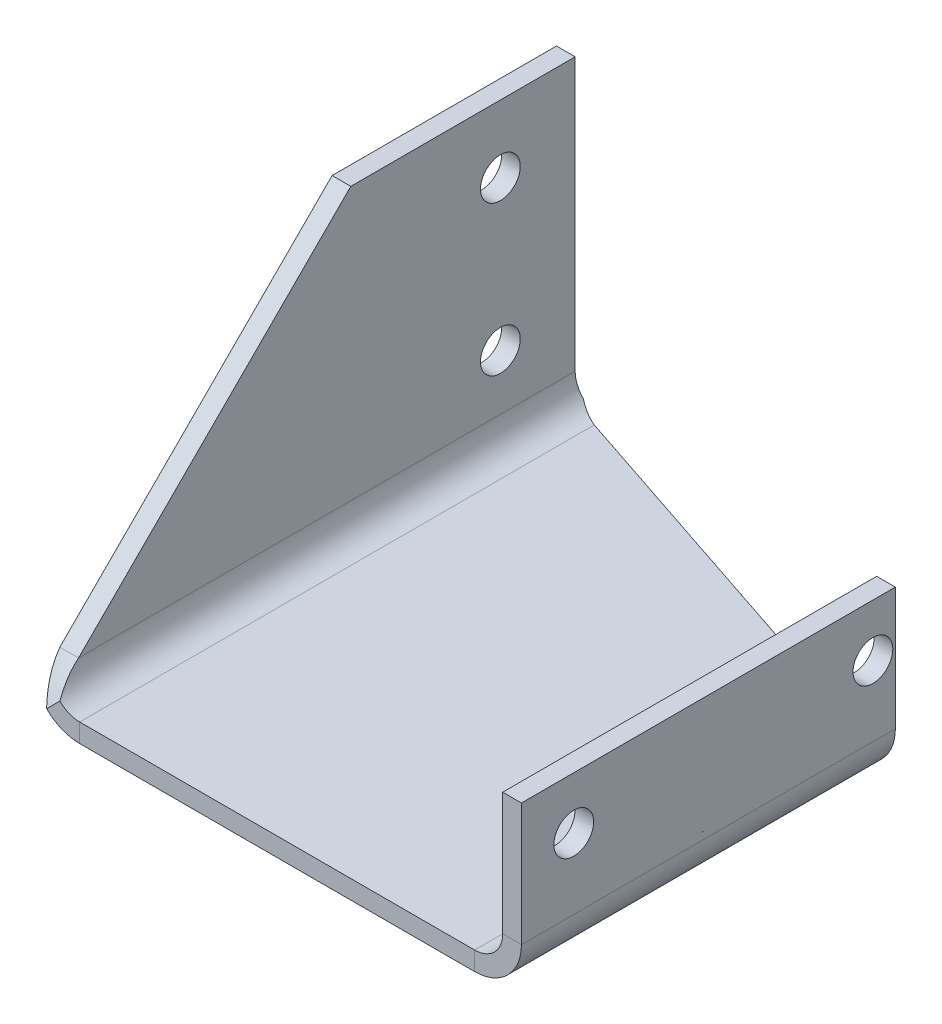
SolidWorks part; units mm, degrees
ref_plane "Front" through (0, 0, 0) normal (0, 0, 1) x (1, 0, 0)
ref_plane "Top" through (0, 0, 0) normal (0, 1, 0) x (1, 0, 0)
ref_plane "Right" through (0, 0, 0) normal (1, 0, 0) x (0, 0, -1)
sketch "Sketch3" plane through (0, 0, 0) normal (0, 1, 0) x (1, 0, 0)
  line L0 (0, 0) -> (0, -38.1)
  line L1 (0, -38.1) -> (50.8, -88.9)
  line L2 (50.8, -88.9) -> (127, -88.9)
  line L4 (50.8, 0) -> (0, 0)
  line L5 (50.8, 0) -> (50.8, -88.9) construction
  line L6 (50.8, 0) -> (127, -25.4)
  line L7 (127, -25.4) -> (127, -88.9) construction
  line L9 (127, -25.4) -> (152.4, -25.4)
  line L10 (152.4, -25.4) -> (152.4, -88.9)
  line L11 (152.4, -88.9) -> (127, -88.9)
  dimension "D1" = 25.4
  dimension "D2" = 38.1
  dimension "D3" = 63.5
  dimension "D4" = 76.2
  dimension "D5" = 50.8
  dimension "D6" = 50.8
base flange "Base-Flange1" sketch "Sketch3" thickness 3.175 reverse thickness direction no parameters "D1"=4.7625
sketch "Sketch8" plane through (0, 0, 0) normal (0, 1, 0) x (1, 0, 0)
  line L0 (50.8, 0) -> (50.8, -88.9) construction
  line L1 (50.8, 0) -> (50.8, -88.9)
  line L2 (127, -25.4) -> (127, -88.9) construction
  line L3 (127, -25.4) -> (127, -88.9)
sketched bend "Sketched Bend2" thickness 3.175 parameters "D1"=0
bend "SketchBend3" bend radius 4.7625 bend angle 90 parameters "D5"=1
bend "SketchBend4" bend radius 0 bend angle 90 parameters "D5"=2
sketch "Sketch9" plane through (47.4259, 0, 0) normal (-1, 0, 0) x (0, 0, 1)
  line L0 (0, 4.7625) -> (0, 50.9991) construction
  line L1 (0, 50.9991) -> (38.1, 50.9991) construction
  point P0 (12.7, 39.5691)
  point P2 (12.7, 14.1691)
  dimension "D1" = 25.4
  dimension "D2" = 12.7
  dimension "D3" = 11.43
hole_wizard "1/4 Clearance Hole1" positions "Sketch9" profile "Sketch10" hole size "1/4" standard "ANSI Inch"
sketch "Sketch10" plane through (47.4259, 39.5691, 12.7) normal (0, 1, 0) x (0, 0, 1)
  line L0 (0, 0) -> (0, 3.175)
  line L1 (0, 3.175) -> (3.3782, 3.175)
  line L2 (3.3782, 3.175) -> (3.3782, 0)
  line L5 (3.3782, 0) -> (0, 0)
  line L11 (0, -6.35) -> (0, 107.95) construction
  dimension "Thru Hole Dia." = 6.7564
  dimension "Thru Hole Depth" = 3.175
sketch "Sketch11" plane through (130.3741, 0, 0) normal (1, 0, 0) x (0, 0, -1)
  line L0 (-88.9, 25.5991) -> (-25.4, 25.5991) construction
  line L1 (-88.9, 4.7625) -> (-88.9, 25.5991) construction
  point P0 (-80.01, 16.7091)
  point P2 (-29.21, 16.7091)
  point P7 (0, 0)
  dimension "D1" = 50.8
  dimension "D2" = 8.89
  dimension "D3" = 8.89
hole_wizard "1/4 Clearance Hole2" positions "Sketch11" profile "Sketch12" hole size "1/4" standard "ANSI Inch"
sketch "Sketch12" plane through (130.3741, 16.7091, 80.01) normal (0, 1, 0) x (0, 0, -1)
  line L0 (0, 0) -> (0, 3.175)
  line L1 (0, 3.175) -> (3.3782, 3.175)
  line L2 (3.3782, 3.175) -> (3.3782, 0)
  line L5 (3.3782, 0) -> (0, 0)
  line L11 (0, -6.35) -> (0, 107.95) construction
  dimension "Thru Hole Dia." = 6.7564
  dimension "Thru Hole Depth" = 3.175
sketch "Bend-Lines1" [suppressed] plane through (0, 0, 0) normal (0, 1, 0) x (1, 0, 0)
sketch "Bounding-Box1" [suppressed] plane through (0, 0, 0) normal (0, 1, 0) x (1, 0, 0)
sheet metal parameters "Sheet-Metal5" thickness 3.175 parameters "D1"=4.7625
flat pattern "Flat-Pattern5"
sketch "Bend-Lines2" plane through (0, 0, 0) normal (0, 1, 0) x (1, 0, 0)
  line L0 (127, -88.9) -> (127, -25.4) construction
  line L1 (50.8, 0) -> (50.8, -88.9) construction
  line L2 (127, -88.9) -> (127, -25.4) construction
  line L3 (50.8, 0) -> (50.8, -88.9) construction
sketch3d "Bounding-Box2" [suppressed]
  line L0 (152.4, -88.9, 0) -> (0, -88.9, 0) construction
  line L1 (152.4, 0, 0) -> (0, 0, 0) construction
  line L2 (152.4, -88.9, 0) -> (152.4, 0, 0) construction
  line L3 (0, -88.9, 0) -> (0, 0, 0) construction
bend of the flat pattern "Flatten-<SketchBend3>1"
bend of the flat pattern "Flatten-<SketchBend4>1"
sheet metal parameters "Sheet-Metal6" thickness 3.175 parameters "D1"=4.7625
flat pattern "Flat-Pattern5"
sketch "Bend-Lines2" plane through (0, 0, 0) normal (0, 1, 0) x (1, 0, 0)
  line L0 (127, -88.9) -> (127, -25.4) construction
  line L1 (50.8, 0) -> (50.8, -88.9) construction
  line L2 (127, -88.9) -> (127, -25.4) construction
  line L3 (50.8, 0) -> (50.8, -88.9) construction
sketch3d "Bounding-Box2" [suppressed]
  line L0 (152.4, -88.9, 0) -> (0, -88.9, 0) construction
  line L1 (152.4, 0, 0) -> (0, 0, 0) construction
  line L2 (152.4, -88.9, 0) -> (152.4, 0, 0) construction
  line L3 (0, -88.9, 0) -> (0, 0, 0) construction
bend of the flat pattern "Flatten-<SketchBend3>1"
bend of the flat pattern "Flatten-<SketchBend4>1"
sheet metal parameters "Sheet-Metal7" thickness 3.175 parameters "D1"=4.7625
flat pattern "Flat-Pattern5"
sketch "Bend-Lines2" plane through (0, 0, 0) normal (0, 1, 0) x (1, 0, 0)
  line L0 (127, -88.9) -> (127, -25.4) construction
  line L1 (50.8, 0) -> (50.8, -88.9) construction
  line L2 (127, -88.9) -> (127, -25.4) construction
  line L3 (50.8, 0) -> (50.8, -88.9) construction
sketch3d "Bounding-Box2" [suppressed]
  line L0 (152.4, -88.9, 0) -> (0, -88.9, 0) construction
  line L1 (152.4, 0, 0) -> (0, 0, 0) construction
  line L2 (152.4, -88.9, 0) -> (152.4, 0, 0) construction
  line L3 (0, -88.9, 0) -> (0, 0, 0) construction
bend of the flat pattern "Flatten-<SketchBend3>1"
bend of the flat pattern "Flatten-<SketchBend4>1"
